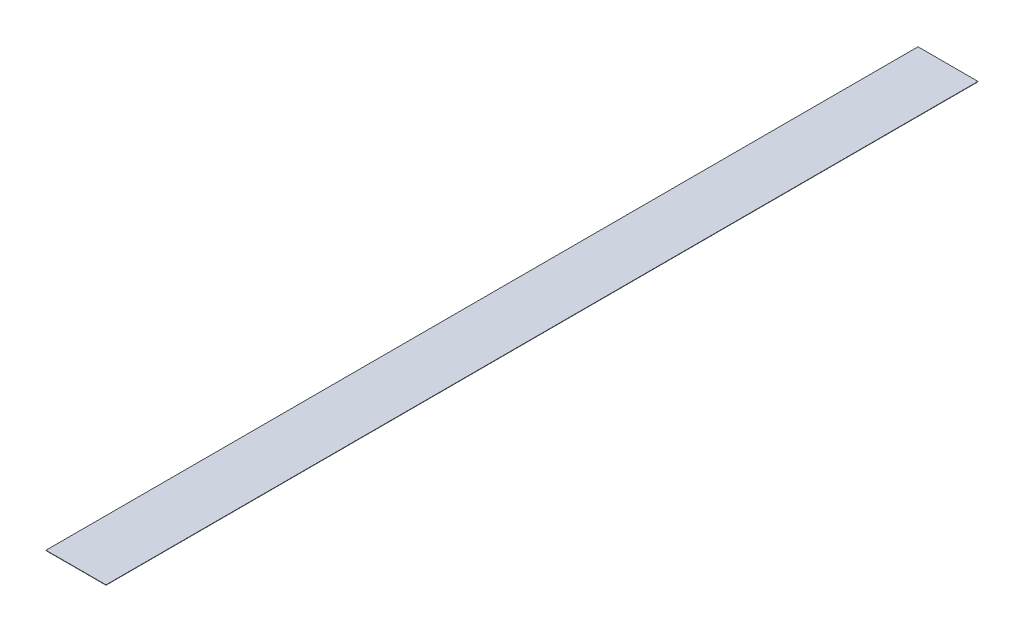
SolidWorks part; units mm, degrees
ref_plane "Front Plane" through (0, 0, 0) normal (0, 0, 1) x (1, 0, 0)
ref_plane "Top Plane" through (0, 0, 0) normal (0, 1, 0) x (1, 0, 0)
ref_plane "Right Plane" through (0, 0, 0) normal (1, 0, 0) x (0, 0, -1)
sketch "Sketch1" plane through (0, 0, 0) normal (0, 1, 0) x (1, 0, 0)
  line L0 (-47.625, 0) -> (0, 0)
  line L2 (0, 0) -> (0, -692.15)
  line L3 (0, -692.15) -> (-47.625, -692.15)
  line L4 (-47.625, 0) -> (-47.625, -692.15)
  dimension "D1" = 692.15
  dimension "D2" = 47.625
extrude "Boss-Extrude1" add sketch "Sketch1" along normal blind 0.254
